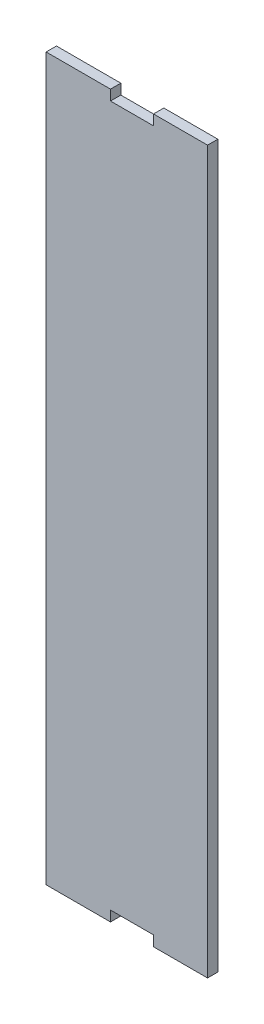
SolidWorks part; units mm, degrees
ref_plane "Front Plane" through (0, 0, 0) normal (0, 0, 1) x (1, 0, 0)
ref_plane "Top Plane" through (0, 0, 0) normal (0, 1, 0) x (1, 0, 0)
ref_plane "Right Plane" through (0, 0, 0) normal (1, 0, 0) x (0, 0, -1)
sketch "Sketch1" plane through (0, 0, 0) normal (0, 0, 1) x (1, 0, 0)
  line L0 (-5.0144, 104.9933) -> (-5.0144, 103.4693)
  line L1 (9.3156, -1.524) -> (1.3356, -1.524)
  line L2 (9.3156, -1.524) -> (9.3156, 104.9933)
  line L3 (9.3156, 104.9933) -> (1.3356, 104.9933)
  line L4 (-14.5184, -1.524) -> (-14.5184, 104.9933)
  line L5 (-5.0144, 103.4693) -> (1.3356, 103.4693)
  line L6 (1.3356, 103.4693) -> (1.3356, 104.9933)
  line L7 (-5.0144, 104.9933) -> (-14.5184, 104.9933)
  line L8 (-5.0144, -1.524) -> (-5.0144, 0)
  line L9 (-5.0144, 0) -> (1.3356, 0)
  line L10 (1.3356, 0) -> (1.3356, -1.524)
  line L11 (-5.0144, -1.524) -> (-14.5184, -1.524)
extrude "Boss-Extrude1" add sketch "Sketch1" along normal blind 1.524
